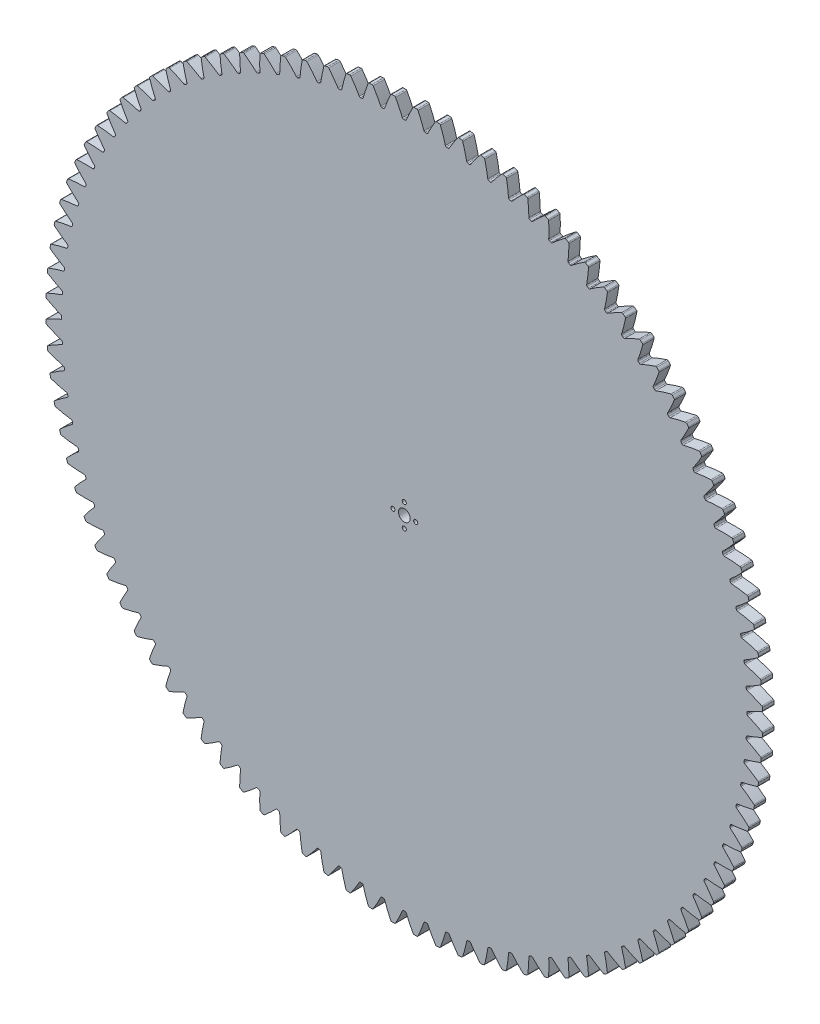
SolidWorks part; units mm, degrees
ref_plane "Front" through (0, 0, 0) normal (0, 0, 1) x (1, 0, 0)
ref_plane "Top" through (0, 0, 0) normal (0, 1, 0) x (1, 0, 0)
ref_plane "Right" through (0, 0, 0) normal (1, 0, 0) x (0, 0, -1)
sketch "Sketch1" plane through (0, 0, 0) normal (0, 0, 1) x (1, 0, 0)
  circle A0 centre (0, 0) radius 398.5846
extrude "Boss-Extrude1" add sketch "Sketch1" along normal blind 12.7
sketch "Sketch3" plane through (0, 0, 0) normal (0, 0, 1) x (1, 0, 0)
  line L0 (0, 0) -> (43.7181, 0) construction
  line L2 (0, 0) -> (5.4357, 380.9612) construction
  line L3 (0, 0) -> (-5.4357, 380.9612) construction
  line L4 (-5.4357, 380.9612) -> (-5.0527, 354.1212) construction
  line L5 (0, 0) -> (0, 61.276) construction
  line L6 (5.4357, 380.9612) -> (5.0527, 354.1212) construction
  circle A0 centre (0, 0) radius 398.5846 construction
  circle A1 centre (0, 0) radius 390.7692 construction
  circle A2 centre (0, 0) radius 354.1572 construction
  arc A3 (-5.4357, 380.9612) -> (5.4357, 380.9612) centre (0, 0) ccw construction
  arc A5 (10.14, 398.4556) -> (-10.14, 398.4556) centre (0, 0) ccw
  spline S0 degree 4 poles (5.0527, 354.1212) (5.053, 354.191) (5.0512, 354.3868) (5.0387, 354.7571) (5.0049, 355.3614) (4.9425, 356.1312) (4.8393, 357.126) (4.6891, 358.2974) (4.4937, 359.5841) (4.2488, 360.9828) (3.9754, 362.3776) (3.6764, 363.7672) (3.3536, 365.1514) (2.9353, 366.8246) (2.3919, 368.8323) (1.7028, 371.1685) (0.8468, 373.8245) (-0.0893, 376.5092) (-1.0843, 379.1714) (-2.0045, 381.4837) (-2.8244, 383.4495) (-3.531, 385.0831) (-4.1044, 386.3772) (-4.8453, 388.0047) (-5.5897, 389.5947) (-6.3785, 391.2224) (-7.3047, 393.0883) (-8.1565, 394.748) (-8.9084, 396.1854) (-9.991, 398.19) (-10.5569, 399.2149) (-11.4479, 400.8069) (-11.8655, 401.5263) (-12.2315, 402.1665) (-12.344, 402.3567) (-12.424, 402.4949) (-12.467, 402.5694) knots 0 0 0 0 0 0.005377 0.015084 0.028532 0.04661 0.064855 0.092111 0.119476 0.146842 0.174209 0.201575 0.228941 0.256307 0.307035 0.361767 0.4165 0.471232 0.525964 0.580697 0.608063 0.635429 0.662795 0.690161 0.744894 0.77226 0.799626 0.854358 0.881725 0.909091 0.954545 0.977273 0.988636 0.994318 1 1 1 1 1 construction
  spline S1 degree 4 poles (5.0527, 354.1212) (5.053, 354.191) (5.0512, 354.3868) (5.0387, 354.7571) (5.0049, 355.3614) (4.9425, 356.1312) (4.8393, 357.126) (4.6891, 358.2974) (4.4937, 359.5841) (4.2488, 360.9828) (3.9754, 362.3776) (3.6764, 363.7672) (3.3536, 365.1514) (2.9353, 366.8246) (2.3919, 368.8323) (1.7028, 371.1685) (0.8468, 373.8245) (-0.0893, 376.5092) (-1.0843, 379.1714) (-2.0045, 381.4837) (-2.8244, 383.4495) (-3.531, 385.0831) (-4.1044, 386.3772) (-4.8453, 388.0047) (-5.5897, 389.5947) (-6.3785, 391.2224) (-7.3047, 393.0883) (-8.1565, 394.748) (-8.9084, 396.1854) (-9.6734, 397.6018) (-9.9846, 398.1725) (-10.14, 398.4556) knots 0 0 0 0 0 0.005377 0.015084 0.028532 0.04661 0.064855 0.092111 0.119476 0.146842 0.174209 0.201575 0.228941 0.256307 0.307035 0.361767 0.4165 0.471232 0.525964 0.580697 0.608063 0.635429 0.662795 0.690161 0.744894 0.77226 0.799626 0.854358 0.881725 0.909091 0.909091 0.909091 0.909091 0.909091
  spline S2 degree 4 poles (-5.0527, 354.1212) (-5.053, 354.191) (-5.0512, 354.3868) (-5.0387, 354.7571) (-5.0049, 355.3614) (-4.9425, 356.1312) (-4.8393, 357.126) (-4.6891, 358.2974) (-4.4937, 359.5841) (-4.2488, 360.9828) (-3.9754, 362.3776) (-3.6764, 363.7672) (-3.3536, 365.1514) (-2.9353, 366.8246) (-2.3919, 368.8323) (-1.7028, 371.1685) (-0.8468, 373.8245) (0.0893, 376.5092) (1.0843, 379.1714) (2.0045, 381.4837) (2.8244, 383.4495) (3.531, 385.0831) (4.1044, 386.3772) (4.8453, 388.0047) (5.5897, 389.5947) (6.3785, 391.2224) (7.3047, 393.0883) (8.1565, 394.748) (8.9084, 396.1854) (9.991, 398.19) (10.5569, 399.2149) (11.4479, 400.8069) (11.8655, 401.5263) (12.2315, 402.1665) (12.344, 402.3567) (12.424, 402.4949) (12.467, 402.5694) knots 0 0 0 0 0 0.005377 0.015084 0.028532 0.04661 0.064855 0.092111 0.119476 0.146842 0.174209 0.201575 0.228941 0.256307 0.307035 0.361767 0.4165 0.471232 0.525964 0.580697 0.608063 0.635429 0.662795 0.690161 0.744894 0.77226 0.799626 0.854358 0.881725 0.909091 0.954545 0.977273 0.988636 0.994318 1 1 1 1 1 construction
  spline S3 degree 4 poles (-5.0527, 354.1212) (-5.053, 354.191) (-5.0512, 354.3868) (-5.0387, 354.7571) (-5.0049, 355.3614) (-4.9425, 356.1312) (-4.8393, 357.126) (-4.6891, 358.2974) (-4.4937, 359.5841) (-4.2488, 360.9828) (-3.9754, 362.3776) (-3.6764, 363.7672) (-3.3536, 365.1514) (-2.9353, 366.8246) (-2.3919, 368.8323) (-1.7028, 371.1685) (-0.8468, 373.8245) (0.0893, 376.5092) (1.0843, 379.1714) (2.0045, 381.4837) (2.8244, 383.4495) (3.531, 385.0831) (4.1044, 386.3772) (4.8453, 388.0047) (5.5897, 389.5947) (6.3785, 391.2224) (7.3047, 393.0883) (8.1565, 394.748) (8.9084, 396.1854) (9.6734, 397.6018) (9.9846, 398.1725) (10.14, 398.4556) knots 0 0 0 0 0 0.005377 0.015084 0.028532 0.04661 0.064855 0.092111 0.119476 0.146842 0.174209 0.201575 0.228941 0.256307 0.307035 0.361767 0.4165 0.471232 0.525964 0.580697 0.608063 0.635429 0.662795 0.690161 0.744894 0.77226 0.799626 0.854358 0.881725 0.909091 0.909091 0.909091 0.909091 0.909091
  point P0 (0, -381)
sketch "DCLTBC" [suppressed] plane through (0, 0, 0) normal (0, 0, 1) x (1, 0, 0)
  line L0 (0, 0) -> (41.04, 0) construction
  line L1 (-0.4786, 4.7258) -> (-0.5479, 5.4102) construction
  line L2 (0.4786, 4.7258) -> (0.5479, 5.4102) construction
  line L3 (-0.4786, 4.7258) -> (-0.5479, 5.4102)
  line L4 (0.4786, 4.7258) -> (0.5479, 5.4102)
  line L5 (0, 0) -> (0, 104.9356) construction
  circle A0 centre (0, 0) radius 7
  circle A1 centre (0, 0) radius 6 construction
  circle A2 centre (0, 0) radius 5.4378 construction
  arc A3 (0.4786, 4.7258) -> (-0.4786, 4.7258) centre (0, 0) ccw construction
  arc A4 (0.4786, 4.7258) -> (-0.4786, 4.7258) centre (0, 0) ccw
  spline S0 degree 4 poles (-994.168, -107.3553) (-12.2, 3.2885) (-0.6588, 4.7874) (-0.4891, 5.1416) (-0.5565, 5.4563) (-0.5637, 5.4847) (-0.5744, 5.521) (-0.5886, 5.5634) (-0.6059, 5.6094) (-0.6266, 5.659) (-0.6489, 5.708) (-0.6726, 5.7563) (-0.6976, 5.8039) (-0.7293, 5.861) (-0.7696, 5.9285) (-0.8198, 6.006) (-0.8803, 6.0922) (-0.9457, 6.1782) (-1.0132, 6.2611) (-1.0849, 6.3428) (-1.1567, 6.4204) (-1.2347, 6.4989) (-1.3084, 6.5702) (-1.3947, 6.6475) (-1.7815, 6.9846) (-3.2646, 8.0433) (17.3538, -8.1004) (-792.2404, 619.045) knots -0.608405 -0.608405 -0.608405 -0.608405 -0.608405 0.005377 0.015084 0.028532 0.04661 0.064855 0.092111 0.119476 0.146842 0.174209 0.201575 0.228941 0.256307 0.307035 0.361767 0.4165 0.471232 0.525964 0.580697 0.635429 0.690161 0.744894 0.799626 0.854358 1.887491 1.887491 1.887491 1.887491 1.887491 only from (-0.5479, 5.4102) to (-1.5983, 6.8151) construction
  spline S1 degree 4 poles (994.168, -107.3553) (12.2, 3.2885) (0.6588, 4.7874) (0.4891, 5.1416) (0.5565, 5.4563) (0.5637, 5.4847) (0.5744, 5.521) (0.5886, 5.5634) (0.6059, 5.6094) (0.6266, 5.659) (0.6489, 5.708) (0.6726, 5.7563) (0.6976, 5.8039) (0.7293, 5.861) (0.7696, 5.9285) (0.8198, 6.006) (0.8803, 6.0922) (0.9457, 6.1782) (1.0132, 6.2611) (1.0849, 6.3428) (1.1567, 6.4204) (1.2347, 6.4989) (1.3084, 6.5702) (1.3947, 6.6475) (1.7815, 6.9846) (3.2646, 8.0433) (-17.3538, -8.1004) (792.2404, 619.045) knots -0.608405 -0.608405 -0.608405 -0.608405 -0.608405 0.005377 0.015084 0.028532 0.04661 0.064855 0.092111 0.119476 0.146842 0.174209 0.201575 0.228941 0.256307 0.307035 0.361767 0.4165 0.471232 0.525964 0.580697 0.635429 0.690161 0.744894 0.799626 0.854358 1.887491 1.887491 1.887491 1.887491 1.887491 only from (0.5479, 5.4102) to (1.5983, 6.8151) construction
  spline S2 degree 4 poles (-0.5479, 5.4102) (-0.5482, 5.4128) (-0.5492, 5.4201) (-0.5517, 5.4339) (-0.5565, 5.4563) (-0.5637, 5.4847) (-0.5744, 5.521) (-0.5886, 5.5634) (-0.6059, 5.6094) (-0.6266, 5.659) (-0.6489, 5.708) (-0.6726, 5.7563) (-0.6976, 5.8039) (-0.7293, 5.861) (-0.7696, 5.9285) (-0.8198, 6.006) (-0.8803, 6.0922) (-0.9457, 6.1782) (-1.0132, 6.2611) (-1.0849, 6.3428) (-1.1567, 6.4204) (-1.2347, 6.4989) (-1.3084, 6.5702) (-1.3947, 6.6475) (-1.4654, 6.7091) (-1.5415, 6.7705) (-1.5789, 6.8001) (-1.5983, 6.8151) knots 0 0 0 0 0 0.005377 0.015084 0.028532 0.04661 0.064855 0.092111 0.119476 0.146842 0.174209 0.201575 0.228941 0.256307 0.307035 0.361767 0.4165 0.471232 0.525964 0.580697 0.635429 0.690161 0.744894 0.799626 0.854358 0.909091 0.909091 0.909091 0.909091 0.909091
  spline S3 degree 4 poles (0.5479, 5.4102) (0.5482, 5.4128) (0.5492, 5.4201) (0.5517, 5.4339) (0.5565, 5.4563) (0.5637, 5.4847) (0.5744, 5.521) (0.5886, 5.5634) (0.6059, 5.6094) (0.6266, 5.659) (0.6489, 5.708) (0.6726, 5.7563) (0.6976, 5.8039) (0.7293, 5.861) (0.7696, 5.9285) (0.8198, 6.006) (0.8803, 6.0922) (0.9457, 6.1782) (1.0132, 6.2611) (1.0849, 6.3428) (1.1567, 6.4204) (1.2347, 6.4989) (1.3084, 6.5702) (1.3947, 6.6475) (1.4654, 6.7091) (1.5415, 6.7705) (1.5789, 6.8001) (1.5983, 6.8151) knots 0 0 0 0 0 0.005377 0.015084 0.028532 0.04661 0.064855 0.092111 0.119476 0.146842 0.174209 0.201575 0.228941 0.256307 0.307035 0.361767 0.4165 0.471232 0.525964 0.580697 0.635429 0.690161 0.744894 0.799626 0.854358 0.909091 0.909091 0.909091 0.909091 0.909091
extrude "Cut-Extrude-DCLTBC" [suppressed] cut sketch "DCLTBC" along normal through all
fillet "Fillet-Tip-DCLTBC" [suppressed] radius 1.3898
fillet "Fillet-Root-DCLTBC" [suppressed] radius 2.7796
pattern_circular "CirPattern-DCLTBC" [suppressed] count 100 over 360
sketch "DCGTBC" plane through (0, 0, 0) normal (0, 0, 1) x (1, 0, 0)
  line L0 (0, 0) -> (41.04, 0) construction
  line L1 (-379.5502, 33.2063) -> (0, 0) construction
  line L2 (0, 0) -> (379.5502, 33.2063) construction
  line L3 (0, 0) -> (-16.5124, 0)
  line L5 (0, 0) -> (0, 104.9356) construction
  circle A0 centre (0, 0) radius 398.5846
  circle A1 centre (0, 0) radius 390.7692 construction
  circle A2 centre (0, 0) radius 354.1572 construction
  arc A3 (-5.4357, 380.9612) -> (5.4357, 380.9612) centre (0, 0) ccw construction
  arc A11 (379.5502, 33.2063) -> (-379.5502, 33.2063) centre (0, 0) ccw
  spline S4 degree 4 poles (994.8894, 352.2105) (19.2542, 343.074) (-4.4669, 346.8096) (-5.2489, 350.9934) (-5.0049, 355.3614) (-4.9425, 356.1312) (-4.8393, 357.126) (-4.6891, 358.2974) (-4.4937, 359.5841) (-4.2488, 360.9828) (-3.9754, 362.3776) (-3.6764, 363.7672) (-3.3536, 365.1514) (-2.9353, 366.8246) (-2.3919, 368.8323) (-1.7028, 371.1685) (-0.8468, 373.8245) (0.0893, 376.5092) (1.0843, 379.1714) (2.0045, 381.4837) (2.8244, 383.4495) (3.531, 385.0831) (4.1044, 386.3772) (4.8453, 388.0047) (5.5897, 389.5947) (6.3785, 391.2224) (7.3047, 393.0883) (8.1565, 394.748) (10.4941, 399.2171) (14.8442, 406.9241) (-7.4917, 365.776) (491.874, 1274.6782) knots -0.290314 -0.290314 -0.290314 -0.290314 -0.290314 0.005377 0.015084 0.028532 0.04661 0.064855 0.092111 0.119476 0.146842 0.174209 0.201575 0.228941 0.256307 0.307035 0.361767 0.4165 0.471232 0.525964 0.580697 0.608063 0.635429 0.662795 0.690161 0.744894 0.77226 0.799626 0.854358 0.881725 1.197701 1.197701 1.197701 1.197701 1.197701 only from (-5.0527, 354.1212) to (10.14, 398.4556) construction
  spline S5 degree 4 poles (-994.8894, 352.2105) (-19.2542, 343.074) (4.4669, 346.8096) (5.2489, 350.9934) (5.0049, 355.3614) (4.9425, 356.1312) (4.8393, 357.126) (4.6891, 358.2974) (4.4937, 359.5841) (4.2488, 360.9828) (3.9754, 362.3776) (3.6764, 363.7672) (3.3536, 365.1514) (2.9353, 366.8246) (2.3919, 368.8323) (1.7028, 371.1685) (0.8468, 373.8245) (-0.0893, 376.5092) (-1.0843, 379.1714) (-2.0045, 381.4837) (-2.8244, 383.4495) (-3.531, 385.0831) (-4.1044, 386.3772) (-4.8453, 388.0047) (-5.5897, 389.5947) (-6.3785, 391.2224) (-7.3047, 393.0883) (-8.1565, 394.748) (-10.4941, 399.2171) (-14.8442, 406.9241) (7.4917, 365.776) (-491.874, 1274.6782) knots -0.290314 -0.290314 -0.290314 -0.290314 -0.290314 0.005377 0.015084 0.028532 0.04661 0.064855 0.092111 0.119476 0.146842 0.174209 0.201575 0.228941 0.256307 0.307035 0.361767 0.4165 0.471232 0.525964 0.580697 0.608063 0.635429 0.662795 0.690161 0.744894 0.77226 0.799626 0.854358 0.881725 1.197701 1.197701 1.197701 1.197701 1.197701 only from (5.0527, 354.1212) to (-10.14, 398.4556) construction
  spline S6 degree 4 poles (-5.0527, 354.1212) (-5.053, 354.191) (-5.0512, 354.3868) (-5.0387, 354.7571) (-5.0049, 355.3614) (-4.9425, 356.1312) (-4.8393, 357.126) (-4.6891, 358.2974) (-4.4937, 359.5841) (-4.2488, 360.9828) (-3.9754, 362.3776) (-3.6764, 363.7672) (-3.3536, 365.1514) (-2.9353, 366.8246) (-2.3919, 368.8323) (-1.7028, 371.1685) (-0.8468, 373.8245) (0.0893, 376.5092) (1.0843, 379.1714) (2.0045, 381.4837) (2.8244, 383.4495) (3.531, 385.0831) (4.1044, 386.3772) (4.8453, 388.0047) (5.5897, 389.5947) (6.3785, 391.2224) (7.3047, 393.0883) (8.1565, 394.748) (8.9084, 396.1854) (9.6734, 397.6018) (9.9846, 398.1725) (10.14, 398.4556) knots 0 0 0 0 0 0.005377 0.015084 0.028532 0.04661 0.064855 0.092111 0.119476 0.146842 0.174209 0.201575 0.228941 0.256307 0.307035 0.361767 0.4165 0.471232 0.525964 0.580697 0.608063 0.635429 0.662795 0.690161 0.744894 0.77226 0.799626 0.854358 0.881725 0.909091 0.909091 0.909091 0.909091 0.909091
  spline S7 degree 4 poles (5.0527, 354.1212) (5.053, 354.191) (5.0512, 354.3868) (5.0387, 354.7571) (5.0049, 355.3614) (4.9425, 356.1312) (4.8393, 357.126) (4.6891, 358.2974) (4.4937, 359.5841) (4.2488, 360.9828) (3.9754, 362.3776) (3.6764, 363.7672) (3.3536, 365.1514) (2.9353, 366.8246) (2.3919, 368.8323) (1.7028, 371.1685) (0.8468, 373.8245) (-0.0893, 376.5092) (-1.0843, 379.1714) (-2.0045, 381.4837) (-2.8244, 383.4495) (-3.531, 385.0831) (-4.1044, 386.3772) (-4.8453, 388.0047) (-5.5897, 389.5947) (-6.3785, 391.2224) (-7.3047, 393.0883) (-8.1565, 394.748) (-8.9084, 396.1854) (-9.6734, 397.6018) (-9.9846, 398.1725) (-10.14, 398.4556) knots 0 0 0 0 0 0.005377 0.015084 0.028532 0.04661 0.064855 0.092111 0.119476 0.146842 0.174209 0.201575 0.228941 0.256307 0.307035 0.361767 0.4165 0.471232 0.525964 0.580697 0.608063 0.635429 0.662795 0.690161 0.744894 0.77226 0.799626 0.854358 0.881725 0.909091 0.909091 0.909091 0.909091 0.909091
  dimension "D1" = 5
  dimension "D2" = 5
extrude "Cut-Extrude-DCGTBC" cut sketch "DCGTBC" along normal through all
fillet "Fillet-Tip-DCGTBC" radius 1.3898 4 edges at (10.14, 398.4556, 6.35) (-10.14, 398.4556, 6.35) (1.8165, 380.9957, 6.35) (-1.8165, 380.9957, 6.35)
pattern_circular "CirPattern-DCGTBC" count 100 over 360 about axis through (0, 0, 12.7) along (0, 0, 1) of "Cut-Extrude-DCGTBC", "Fillet-Tip-DCGTBC"
sketch "Sketch4" plane through (0, 0, 12.7) normal (0, 0, 1) x (1, 0, 0)
  circle A1 centre (0, 0) radius 6.5
extrude "Cut-Extrude2" cut sketch "Sketch4" against normal through all
sketch "Sketch5" plane through (0, 0, 12.7) normal (0, 0, 1) x (1, 0, 0)
  circle A0 centre (-12.7, 0) radius 2.286
  circle A1 centre (0, 12.7) radius 2.286
  circle A2 centre (12.7, 0) radius 2.286
  circle A3 centre (0, -12.7) radius 2.286
  point P12 (0, 0)
  dimension "D2" = 4.572
  dimension "D1" = 12.7
  dimension "D3" = 4
extrude "Cut-Extrude3" cut sketch "Sketch5" against normal through all
equation "\"DiametralPitch\"= 1.625 * 2'Diametral Pitch"
equation "\"NumTeeth\"= 100'Number of Teeth"
equation "\"PressureAngle\"= 25deg'Pressure Angle"
equation "\"Addendum\"= 1 / \"DiametralPitch\"'Addendum"
equation "\"Dedendum\"= 1.25 / \"DiametralPitch\"'Dedendum"
equation "\"WorkingDepth\"= 2 / \"DiametralPitch\"'Working Depth - here for REF (Not used in building model)"
equation "\"WholeDepth\"= 2.25 / \"DiametralPitch\"'Whole Depth - here for REF (Not used in building model)"
equation "\"Clearance\"= .25 / \"DiametralPitch\"'Clearance"
equation "\"CircularPitch\"= pi / \"DiametralPitch\"'Circular Pitch - here for REF (Not used in building model)"
equation "\"PitchCircle\"= \"NumTeeth\" / \"DiametralPitch\"'Pitch Circle - or - Pitch Diameter"
equation "\"OutsideDiameter\"= ( \"NumTeeth\" + 2 ) / \"DiametralPitch\"'Outside Diameter"
equation "\"Fillet_Root\"= \"Clearance\" * cos ( \"PressureAngle\" ) * tan ( ( 90 + \"PressureAngle\" ) / 2 ) 'Fillet Root"
equation "\"AddendumCircle\"= \"PitchCircle\" + ( 2 * \"Addendum\" )'Addendum Circle - or - Addendum Diameter"
equation "\"DedendumCircle\"= \"PitchCircle\" - ( 2 * \"Dedendum\" )'Dedendum Circle - or - Dedendum Diameter"
equation "\"BaseCircle\"= \"PitchCircle\" * cos ( \"PressureAngle\" )'Base Circle - Base Diameter"
equation "\"PitchAngle\"= 360deg / \"NumTeeth\"'Pitch Angle"
equation "\"Alpha\"= sqr ( \"PitchCircle\" ^ 2 - \"BaseCircle\" ^ 2 ) / \"BaseCircle\" * 180 / PI - \"PressureAngle\"'Alpha - Used for Calculating Beta"
equation "\"Beta\"= ( \"PitchAngle\" / 4 - ( \"Alpha\" - 90 ) )'Beta - Used in definition of the parameters for the parametric equation driven curve"
equation "\"Gamma\"= ( \"PitchAngle\" / 4 - ( \"Alpha\" + 90 ) )'Gamma - Used in definition of the parameters for the parametric equation driven curve"
equation "\"Phi\"= sqr ( ( \"AddendumCircle\" / 2 ) ^ 2 - ( \"BaseCircle\" / 2 ) ^ 2 ) / ( \"BaseCircle\" / 2 )'Phi - Used in definition of the parameters for the parametric equation driven curve"
equation "\"DCGTBC\"= iif ( \"DedendumCircle\" > \"BaseCircle\" , \"unsuppressed\" , \"suppressed\" )'if Dedendum Circle IS GREATER THAN BaseCircle THEN UnsuppressORSuppress FEATURE"
equation "\"DCLTBC\"= iif ( \"DedendumCircle\" - .002 > \"BaseCircle\" , \"suppressed\" , \"unsuppressed\" )'if Dedendum Circle - .002 IS GREATER THAN BaseCircle THEN SuppressORUnsuppress FEATURE"
equation "\"Cut-Extrude-DCGTBC\"= iif ( \"DedendumCircle\" > \"BaseCircle\" , \"unsuppressed\" , \"suppressed\" )'if Dedendum Circle IS GREATER THAN BaseCircle THEN UnsuppressORSuppress FEATURE"
equation "\"Cut-Extrude-DCLTBC\"= iif ( \"DedendumCircle\" - .002 > \"BaseCircle\" , \"suppressed\" , \"unsuppressed\" )'if Dedendum Circle - .002 IS GREATER THAN BaseCircle THEN SuppressORUnsuppress FEATURE"
equation "\"CirPattern-DCGTBC\"= iif ( \"DedendumCircle\" > \"BaseCircle\" , \"unsuppressed\" , \"suppressed\" )'if Dedendum Circle IS GREATER THAN BaseCircle THEN UnsuppressORSuppress FEATURE"
equation "\"CirPattern-DCLTBC\"= iif ( \"DedendumCircle\" - .002 > \"BaseCircle\" , \"suppressed\" , \"unsuppressed\" )'if Dedendum Circle - .002 IS GREATER THAN BaseCircle THEN SuppressORUnsuppress FEATURE"
equation "\"Fillet-Tip-DCGTBC\"= iif ( \"DedendumCircle\" > \"BaseCircle\" , \"unsuppressed\" , \"suppressed\" )'if Dedendum Circle IS GREATER THAN BaseCircle THEN UnsuppressORSuppress FEATURE"
equation "\"Fillet-Tip-DCLTBC\"= iif ( \"DedendumCircle\" - .002 > \"BaseCircle\" , \"suppressed\" , \"unsuppressed\" )'if Dedendum Circle - .002 IS GREATER THAN BaseCircle THEN SuppressORUnsuppress FEATURE"
equation "\"Fillet-Root-DCLTBC\"= iif ( \"DedendumCircle\" - .002 > \"BaseCircle\" , \"suppressed\" , \"unsuppressed\" )'if Dedendum Circle - .002 IS GREATER THAN BaseCircle THEN SuppressORUnsuppress FEATURE"
equation "\"D1@CirPattern-DCGTBC\"= \"NumTeeth\"'Number of Teeth"
equation "\"D1@CirPattern-DCLTBC\"= \"NumTeeth\"'Number of Teeth"
equation "\"D1@Fillet-Tip-DCGTBC\"= \"Fillet_Root\" / 2 'Tip Rad For Large No of Teeth"
equation "\"D1@Fillet-Tip-DCLTBC\"=\"Fillet_Root\" / 2'Tip Rad For Small No of Teeth"
equation "\"D1@Fillet-Root-DCLTBC\"= \"Fillet_Root\"'Fillet Root"
